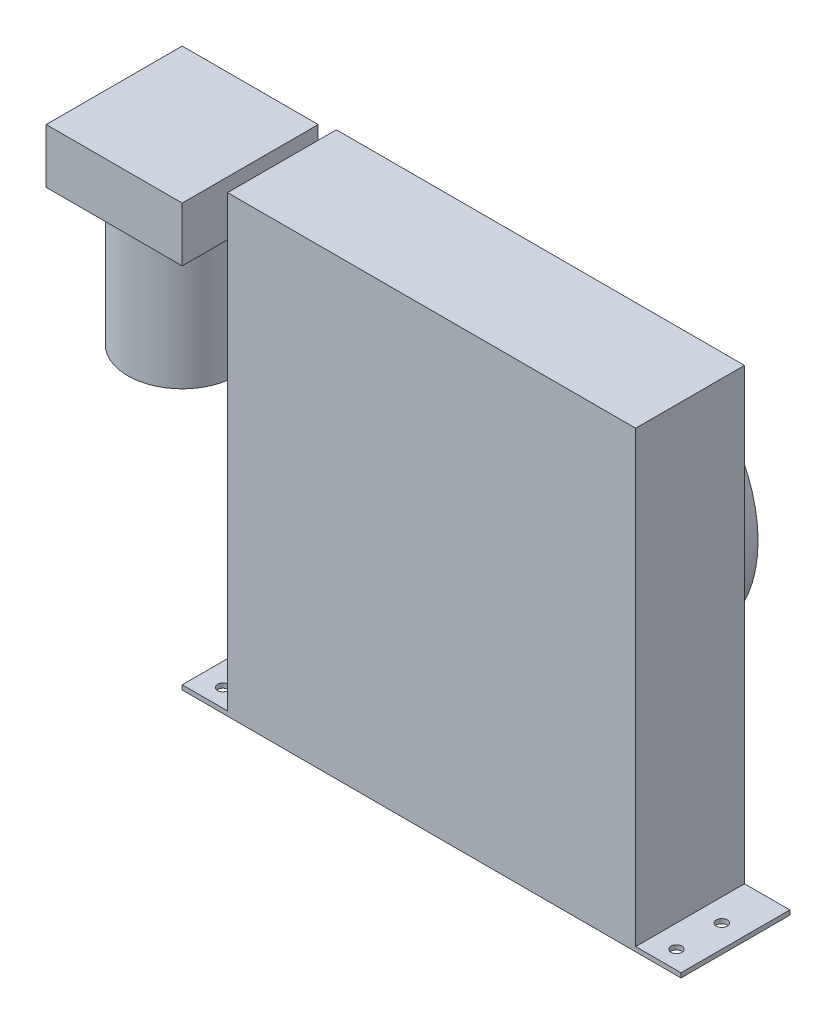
SolidWorks part; units mm, degrees
ref_plane "前视基准面" through (0, 0, 0) normal (0, 0, 1) x (1, 0, 0)
ref_plane "上视基准面" through (0, 0, 0) normal (0, 1, 0) x (1, 0, 0)
ref_plane "右视基准面" through (0, 0, 0) normal (1, 0, 0) x (0, 0, -1)
sketch "草图1" plane through (0, 0, 0) normal (0, 0, 1) x (1, 0, 0)
  line L1 (-225, 250) -> (225, 250)
  line L2 (-225, 250) -> (-225, -250)
  line L3 (-225, -250) -> (225, -250)
  line L4 (225, 250) -> (225, -250)
  dimension "D1" = 500
  dimension "D2" = 450
  dimension "D3" = 225
  dimension "D4" = 250
extrude "拉伸1" add sketch "草图1" along normal blind 120
sketch "草图2" plane through (0, 0, 0) normal (0, 0, -1) x (-1, 0, 0)
  circle A0 centre (0, 0) radius 150
  dimension "D1" = 300
extrude "拉伸2" add sketch "草图2" along normal blind 90
sketch "草图3" plane through (-225, 0, 0) normal (-1, 0, 0) x (0, 0, 1)
  line L0 (0, 250) -> (0, -250) construction
  line L1 (120, 250) -> (0, 250) construction
  circle A0 centre (60, 190) radius 20
  dimension "D1" = 40
  dimension "D2" = 60
  dimension "D3" = 60
extrude "拉伸3" add sketch "草图3" along normal blind 40
ref_plane "基准面1" through (0, 225, 0) normal (0, 1, 0) x (-1, 0, 0)
sketch "草图4" plane through (0, 225, 0) normal (0, 1, 0) x (-1, 0, 0)
  line L0 (265, 40) -> (265, 80) construction
  line L1 (415, 130) -> (265, 130)
  line L2 (415, 130) -> (415, -20)
  line L3 (415, -20) -> (265, -20)
  line L4 (265, 130) -> (265, -20)
  line L5 (225, 40) -> (265, 40) construction
  dimension "D1" = 150
  dimension "D2" = 150
  dimension "D3" = 60
extrude "拉伸4" add sketch "草图4" against normal blind 60
sketch "草图5" plane through (0, 165, 0) normal (0, -1, 0) x (1, 0, 0)
  line L0 (-415, -20) -> (-415, 130) construction
  line L1 (-415, 130) -> (-265, 130) construction
  circle A0 centre (-340, 55) radius 60
  dimension "D1" = 120
  dimension "D2" = 75
  dimension "D3" = 75
extrude "拉伸5" add sketch "草图5" along normal blind 150
sketch "草图6" plane through (-225, 0, 0) normal (-1, 0, 0) x (0, 0, 1)
  line L0 (0, 250) -> (0, -250) construction
  line L1 (120, -250) -> (0, -250)
  line L2 (120, -250) -> (120, -245)
  line L3 (120, -245) -> (0, -245)
  line L4 (0, -250) -> (0, -245)
  dimension "D1" = 5
extrude "拉伸6" add sketch "草图6" along normal blind 50
sketch "草图7" plane through (0, -250, 0) normal (0, -1, 0) x (1, 0, 0)
  line L0 (-250, 169.6723) -> (-250, -80.1404) construction
  line L1 (-275, 120) -> (225, 120) construction
  circle A0 centre (-250, 50) radius 6
  circle A1 centre (-250, 100) radius 6
  dimension "D2" = 50
  dimension "D3" = 20
  dimension "D4" = 12
  dimension "D5" = 12
  dimension "D1" = 250
extrude "切除-拉伸1" cut sketch "草图7" against normal blind 50
mirror "镜向1" about plane through (0, 0, 0) normal (1, 0, 0) of "切除-拉伸1", "拉伸6"
